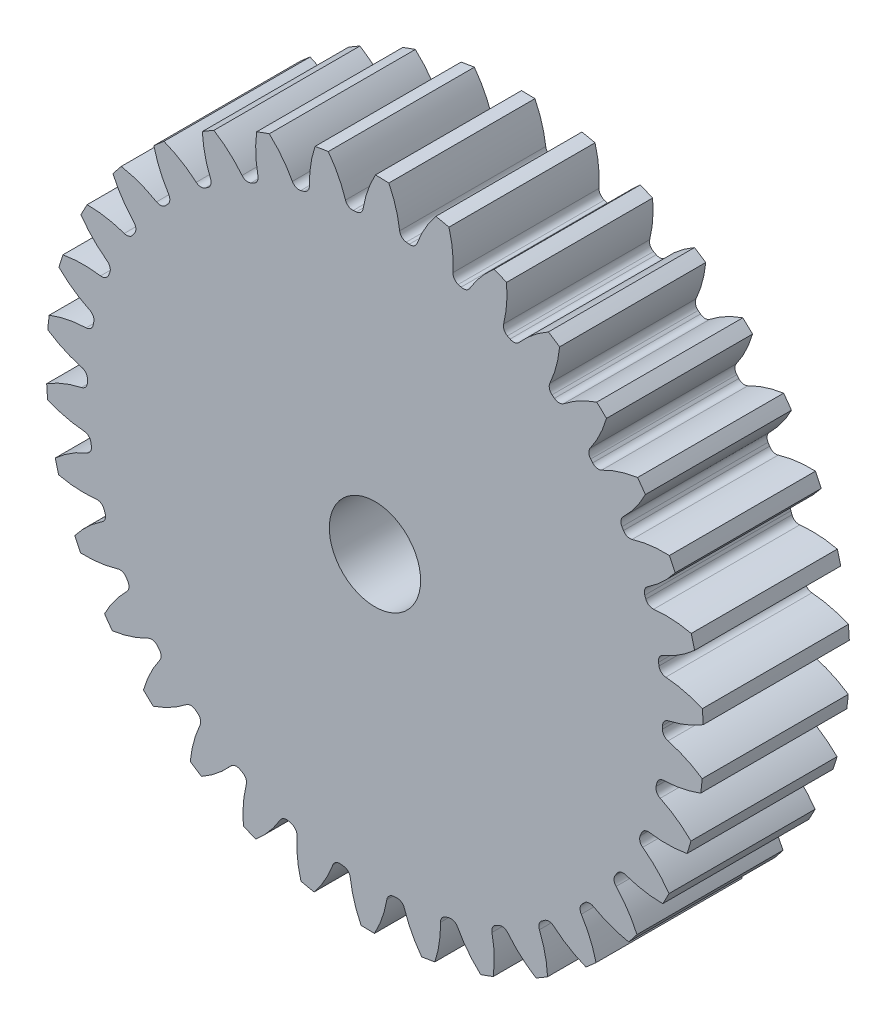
SolidWorks part; units mm, degrees
ref_plane "Front" through (0, 0, 0) normal (0, 0, 1) x (1, 0, 0)
ref_plane "Top" through (0, 0, 0) normal (0, 1, 0) x (1, 0, 0)
ref_plane "Right" through (0, 0, 0) normal (1, 0, 0) x (0, 0, -1)
sketch "Sketch3" plane through (0, 0, 0) normal (0, 0, 1) x (1, 0, 0)
  circle A0 centre (0, 0) radius 228.6
  dimension "od" = 457.2
extrude "gearBody" add sketch "Sketch3" along normal blind 101.6
sketch "Sketch2" plane through (0, 0, 0) normal (0, 0, 1) x (1, 0, 0)
  line L0 (0, 0) -> (187.4363, 77.6387) construction
  line L1 (227.8732, -21.613) -> (0, 0) construction
  line L2 (0, 0) -> (36.3143, 0) construction
  line L3 (215.8369, 5.2199) -> (215.4026, -14.6473) construction
  line L5 (215.6197, -4.7137) -> (0, 0) construction
  line L7 (0, 0) -> (202.8796, 0) construction
  arc A0 (202.8748, 1.3975) -> (202.6199, -10.262) centre (0, 0) ccw construction
  arc A1 (228.3128, 11.4557) -> (227.594, -21.4223) centre (0, 0) ccw construction
  arc A2 (215.8369, 5.2199) -> (215.4026, -14.6473) centre (0, 0) ccw construction
  arc A3 (199.9514, -5.4268) -> (199.9975, -3.3165) centre (0, 0) ccw
  arc A4 (227.8732, -21.613) -> (203.7941, -10.5635) centre (183.8644, -85.7557) ccw
  arc A5 (227.8732, -21.613) -> (228.6, 11.634) centre (0, 0) ccw
  arc A6 (228.6, 11.634) -> (204.061, 1.6473) centre (187.4363, 77.6387) cw
  arc A7 (199.9975, -3.3165) -> (204.061, 1.6473) centre (205.1657, -3.4022) cw
  arc A8 (203.7941, -10.5635) -> (199.9514, -5.4268) centre (205.1184, -5.5671) cw
  point P6 (228.6, 11.634)
  point P22 (227.8732, -21.613)
  dimension "baseDia" = 405.7593
  dimension "od" = 457.2
  dimension "pd" = 431.8
  dimension "rd" = 400.05
  dimension "rFillet" = 5.1689
  dimension "pointX" = 228.6
  dimension "pointY" = 11.634
  dimension "CTT" = 19.8672
  dimension "flankCenterAngle" = 22.5
extrude "toothCut" cut sketch "Sketch2" along normal through all
pattern_circular "CirPattern1" count 34 over 360 about axis through (0, 0, 0) along (0, 0, 1) of "toothCut"
sketch "hub1Dia" plane through (0, 0, 0) normal (0, 0, -1) x (-1, 0, 0)
  circle A0 centre (0, 0) radius 12.7
  dimension "hub1Dia" = 25.4
sketch "hub2Dia" plane through (0, 0, 101.6) normal (0, 0, 1) x (1, 0, 0)
  circle A0 centre (0, 0) radius 12.7
  dimension "hub2dia" = 25.4
sketch "boreDia" plane through (0, 0, 0) normal (0, 0, 1) x (1, 0, 0)
  circle A0 centre (0, 0) radius 31.75
  dimension "boreDia" = 63.5
extrude "bore" cut sketch "boreDia" against normal mid plane 25400
